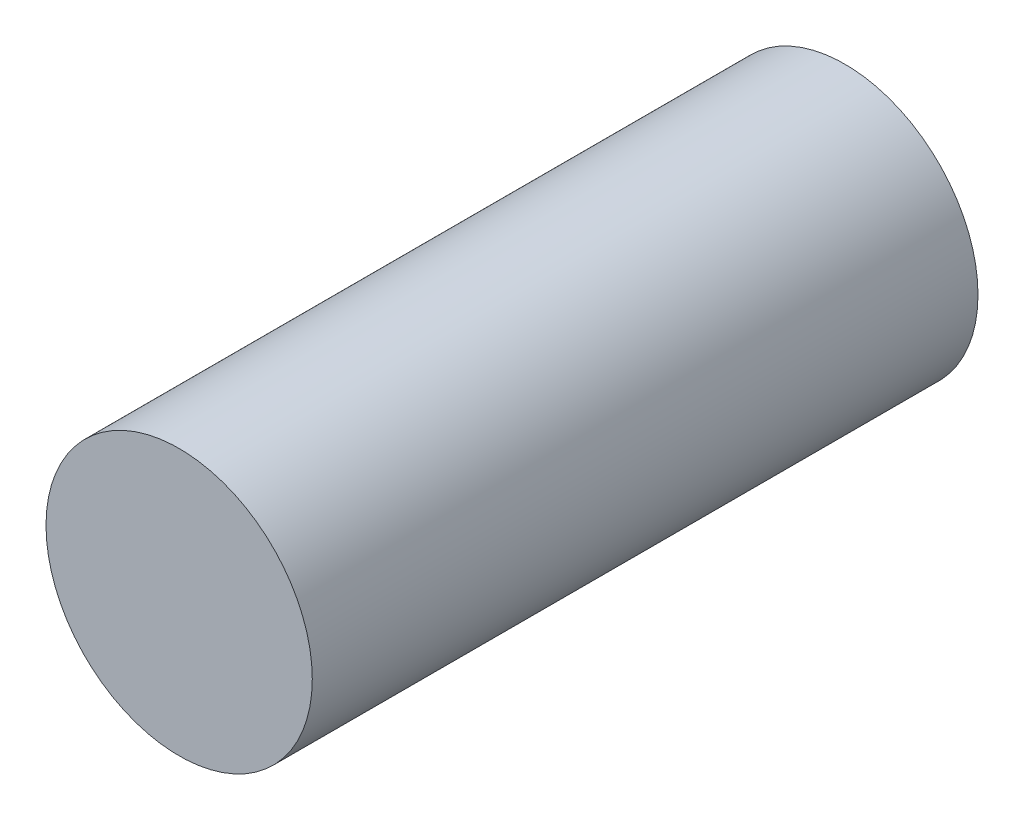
SolidWorks part; units mm, degrees
ref_plane "Front Plane" through (0, 0, 0) normal (0, 0, 1) x (1, 0, 0)
ref_plane "Top Plane" through (0, 0, 0) normal (0, 1, 0) x (1, 0, 0)
ref_plane "Right Plane" through (0, 0, 0) normal (1, 0, 0) x (0, 0, -1)
sketch "Sketch1" plane through (0, 0, 0) normal (0, 0, 1) x (1, 0, 0)
  circle A0 centre (0, 0) radius 30
  dimension "D1" = 60
extrude "Boss-Extrude1" add sketch "Sketch1" against normal blind 150
